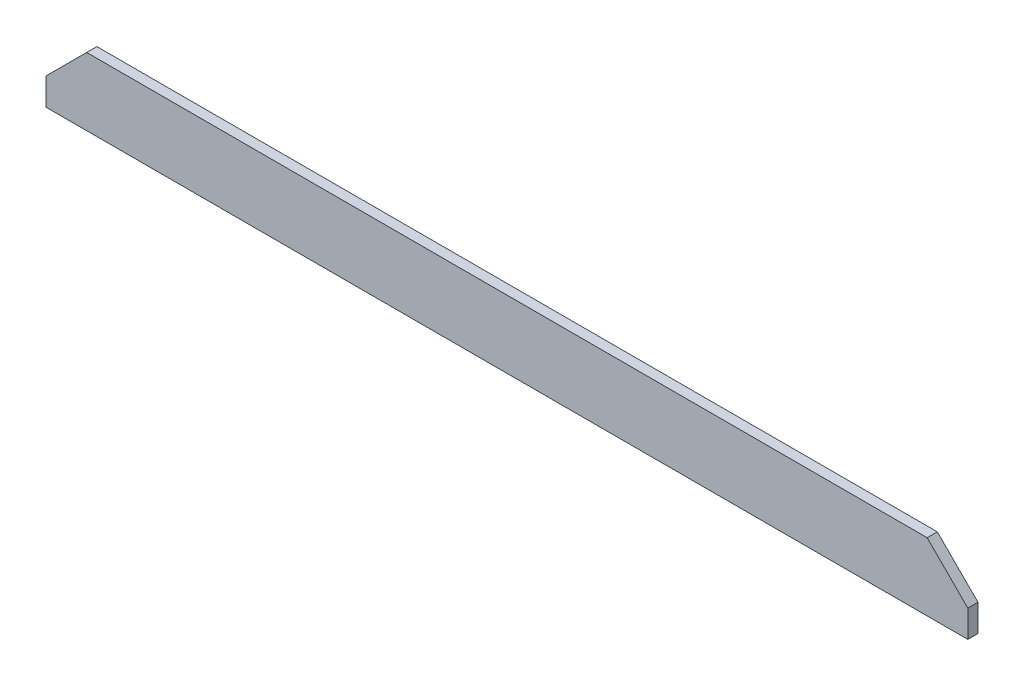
SolidWorks part; units mm, degrees
ref_plane "Front Plane" through (0, 0, 0) normal (0, 0, 1) x (1, 0, 0)
ref_plane "Top Plane" through (0, 0, 0) normal (0, 1, 0) x (1, 0, 0)
ref_plane "Right Plane" through (0, 0, 0) normal (1, 0, 0) x (0, 0, -1)
sketch "Sketch1" plane through (0, 0, 0) normal (0, 0, 1) x (1, 0, 0)
  line L1 (0, 0) -> (863.6, 0)
  line L2 (0, 0) -> (0, -63.5)
  line L3 (0, -63.5) -> (863.6, -63.5)
  line L4 (863.6, 0) -> (863.6, -63.5)
  dimension "D1" = 63.5
  dimension "D2" = 863.6
extrude "Extrude1" add sketch "Sketch1" against normal blind 9.525
chamfer "Chamfer1" distance 38.1 angle 45 1 edges at (0, 0, -4.7625)
chamfer "Chamfer2" distance 38.1 angle 45 1 edges at (863.6, 0, -4.7625)
